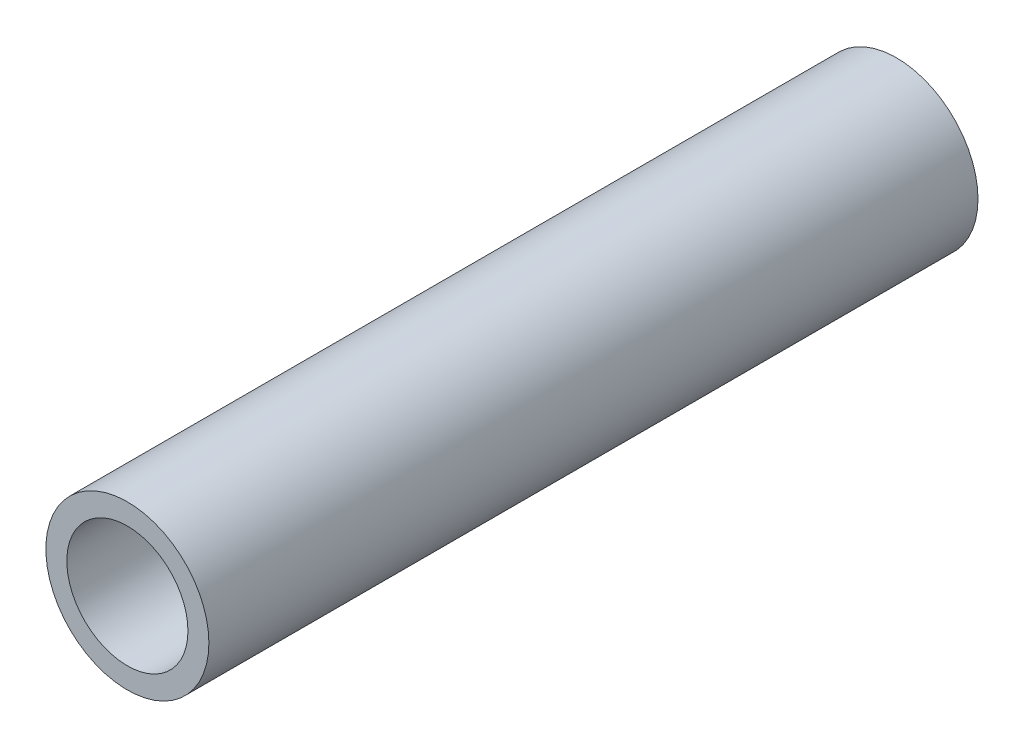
SolidWorks part; units mm, degrees
ref_plane "Front Plane" through (0, 0, 0) normal (0, 0, 1) x (1, 0, 0)
ref_plane "Top Plane" through (0, 0, 0) normal (0, 1, 0) x (1, 0, 0)
ref_plane "Right Plane" through (0, 0, 0) normal (1, 0, 0) x (0, 0, -1)
sketch "Sketch1" plane through (0, 0, 0) normal (0, 0, 1) x (1, 0, 0)
  circle A0 centre (0, 0) radius 10.7696
  circle A1 centre (0, 0) radius 8.001
  dimension "D1" = 21.5392
  dimension "D2" = 16.002
extrude "Boss-Extrude1" add sketch "Sketch1" along normal mid plane 101.6
